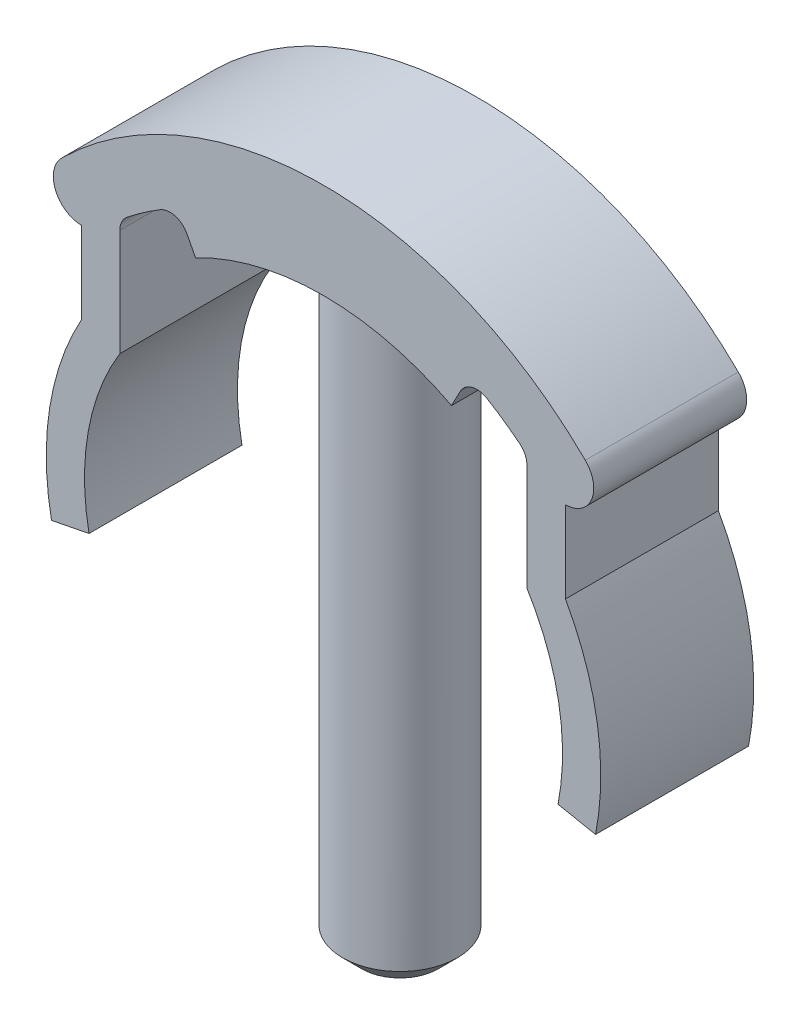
SolidWorks part; units mm, degrees
ref_plane "Спереди" through (0, 0, 0) normal (0, 0, 1) x (1, 0, 0)
ref_plane "Сверху" through (0, 0, 0) normal (0, 1, 0) x (1, 0, 0)
ref_plane "Справа" through (0, 0, 0) normal (1, 0, 0) x (0, 0, -1)
sketch "Эскиз1" plane through (0, 0, 0) normal (0, 0, 1) x (1, 0, 0)
  line L0 (10.6365, 12.1404) -> (10.6365, 6.5663)
  line L1 (-10.6535, 12.1268) -> (-10.6535, 6.5385)
  line L2 (0, 0) -> (-10.6535, 0) construction
  line L3 (0, 0) -> (10.6365, 0) construction
  line L4 (-14.2274, -2.7984) -> (-12.265, -2.4124)
  line L5 (12.6535, 11.3529) -> (12.6535, 7.0808)
  line L6 (12.265, -2.4124) -> (14.2274, -2.7984)
  line L7 (0, 26.0638) -> (0, -34.4418) construction
  line L8 (-6.6937, 12.8625) -> (-7.1404, 13.721)
  line L9 (6.6937, 12.8625) -> (7.1404, 13.721)
  line L10 (-12.6535, 11.3529) -> (-12.6535, 7.0808)
  line L11 (-8.5454, -17) -> (6.6937, -17) construction
  arc A0 (-10.6535, 6.5385) -> (-12.265, -2.4124) centre (0, 0) ccw
  arc A1 (-12.6535, 7.0808) -> (-14.2274, -2.7984) centre (0, 0) ccw
  circle A2 centre (0, 0) radius 14.5 construction
  arc A3 (6.6937, 12.8625) -> (-6.6937, 12.8625) centre (0, 0) ccw
  arc A4 (13.6919, 13.8846) -> (-13.6919, 13.8846) centre (0, 0) ccw
  arc A5 (-12.6535, 11.3529) -> (12.6535, 11.3529) centre (0, 0) ccw
  arc A6 (-13.6919, 13.8846) -> (-12.6535, 11.3529) centre (-12.6535, 12.8317) ccw
  arc A7 (12.6535, 11.3529) -> (13.6919, 13.8846) centre (12.6535, 12.8317) ccw
  circle A8 centre (0, 0) radius 17 construction
  circle A9 centre (0, 0) radius 12.5 construction
  circle A10 centre (0, 0) radius 19.5 construction
  arc A11 (12.265, -2.4124) -> (10.6365, 6.5663) centre (0, 0) ccw
  arc A12 (14.2274, -2.7984) -> (12.6535, 7.0808) centre (0, 0) ccw
  arc A13 (-8.5454, 14.1148) -> (-10.2764, 12.9092) centre (0, 0) ccw
  arc A14 (10.6365, 12.1404) -> (10.2582, 12.9236) centre (9.6365, 12.1404) ccw
  arc A15 (10.2582, 12.9236) -> (8.5454, 14.1148) centre (0, 0) ccw
  arc A16 (8.5454, 14.1148) -> (7.1404, 13.721) centre (8.0275, 13.2593) ccw
  arc A17 (-10.6535, 12.1268) -> (-10.2764, 12.9092) centre (-9.6535, 12.1268) cw
  arc A18 (-7.1404, 13.721) -> (-8.5454, 14.1148) centre (-8.0275, 13.2593) ccw
  point P23 (-12.6535, 11.3529)
  point P39 (-7.6169, 14.6367)
  dimension "D1" = 25
  dimension "D6" = 39
  dimension "D8" = 2.9576
  dimension "D11" = 54.985
  dimension "D12" = 33
  dimension "D10" = 1
  dimension "D3" = 21.29
  dimension "D4" = 10.6535
  dimension "D5" = 12.6535
  dimension "D9" = 24.53
  dimension "D2" = 2
  dimension "D7" = 2.5
extrude "Бобышка-Вытянуть1" add sketch "Эскиз1" along normal blind 8 contours A18 L8 A3 L9 A16 A15 A14 L0 A11 L6 A12 L5 A7 A4 A6 L10 A1 L4 A0 L1 A17 A13
ref_plane "Плоскость1" through (0, -17, 0) normal (0, 1, 0) x (-1, 0, 0)
sketch "Эскиз2" plane through (0, 0, 0) normal (0, 1, 0) x (1, 0, 0)
  line L0 (0, 2.9963) -> (0, -9.7266) construction
  line L1 (-12.4821, -4) -> (6.3815, -4) construction
  line L2 (-13.6919, -8) -> (13.6919, -8) construction
  circle A0 centre (0, -4) radius 3
  dimension "D1" = 6
  dimension "D2" = 4
extrude "Бобышка-Вытянуть2" add sketch "Эскиз2" along normal up to surface and the other way up to surface (17 mm away)
chamfer "Фаска1" distance 1 angle 45 1 edges at (0, -17, 7)
